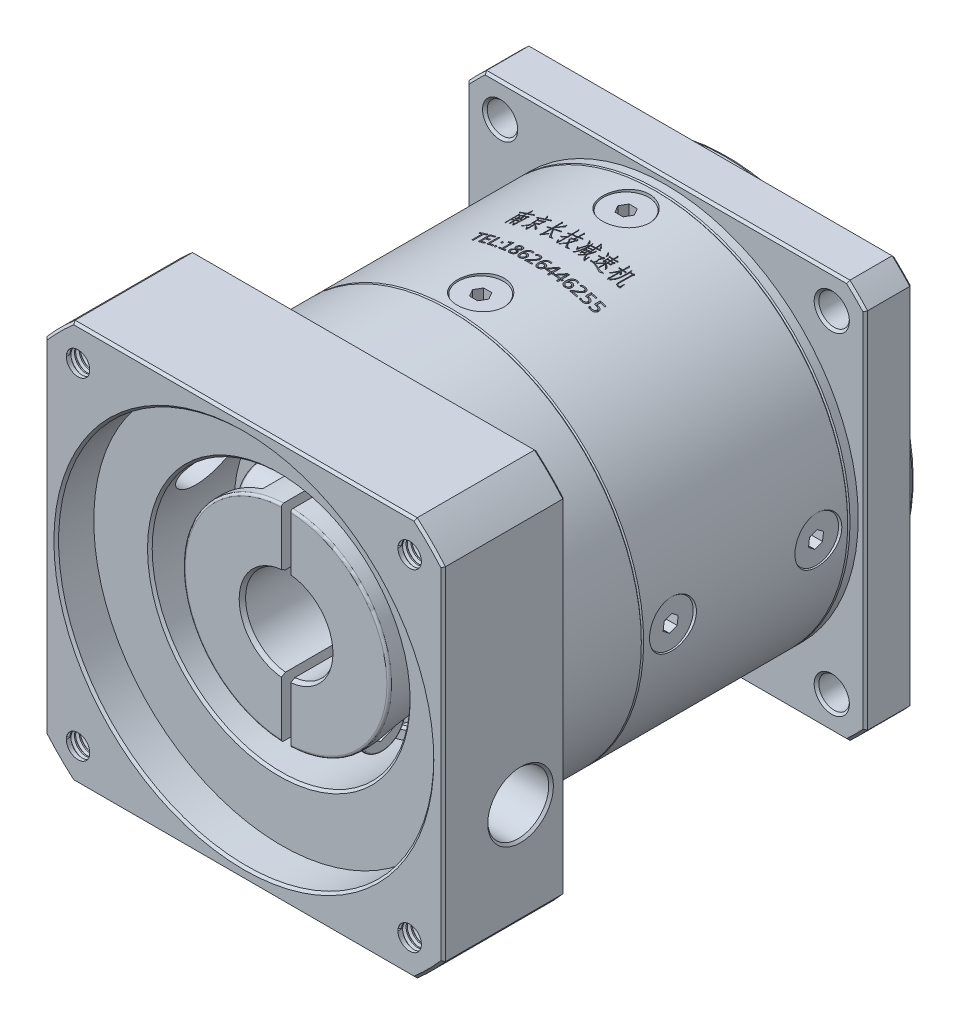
SolidWorks part; units mm, degrees
ref_plane "前视基准面" through (0, 0, 0) normal (0, 0, 1) x (1, 0, 0)
ref_plane "上视基准面" through (0, 0, 0) normal (0, 1, 0) x (1, 0, 0)
ref_plane "右视基准面" through (0, 0, 0) normal (1, 0, 0) x (0, 0, -1)
imported_body "19-80-100-M6-1-solid1"
imported_body "19-80-100-M6-1-solid2"
imported_body "19-80-100-M6-1-solid3"
imported_body "19-80-100-M6-1-solid4"
imported_body "ZF80-K15-L1-8-solid1"
imported_body "ZF80-K15-L1-8-solid2"
imported_body "ZF80-K15-L1-8-solid3"
imported_body "ZF80-K15-L1-8-solid4"
imported_body "ZF80-K15-L1-8-solid5"
imported_body "ZF80-K15-L1-8-solid6"
imported_body "ZF80-K15-L1-8-solid7"
imported_body "ZF80-K15-L1-8-solid8"
imported_body "ZF80-K15-L1-8-solid9"
sketch "草图1" plane through (0, 0, -41.7927) normal (0, 0, -1) x (-1, 0, 0)
  circle A0 centre (93.2642, 24.5962) radius 11.0092
  dimension "D1" = 22.0185
extrude "凸台-拉伸1" add sketch "草图1" along normal blind 5
